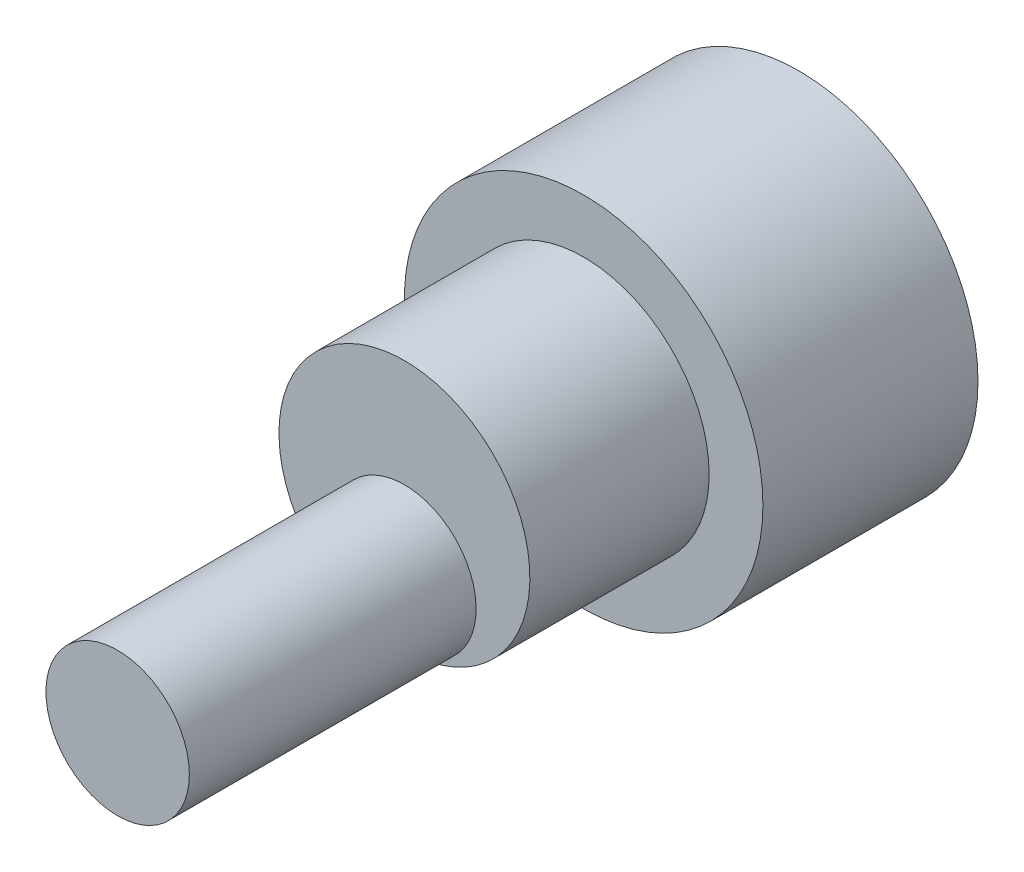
SolidWorks part; units mm, degrees
ref_plane "前视基准面" through (0, 0, 0) normal (0, 0, 1) x (1, 0, 0)
ref_plane "上视基准面" through (0, 0, 0) normal (0, 1, 0) x (1, 0, 0)
ref_plane "右视基准面" through (0, 0, 0) normal (1, 0, 0) x (0, 0, -1)
sketch "草图1" plane through (0, 0, 0) normal (0, 0, 1) x (1, 0, 0)
  circle A0 centre (0, 0) radius 50
  dimension "D1" = 100
extrude "拉伸1" add sketch "草图1" along normal blind 60
sketch "草图2" plane through (0, 0, 60) normal (0, 0, 1) x (1, 0, 0)
  circle A0 centre (0, 0) radius 35
  dimension "D1" = 70
extrude "拉伸2" add sketch "草图2" along normal blind 50
sketch "草图3" plane through (0, 0, 110) normal (0, 0, 1) x (1, 0, 0)
  circle A0 centre (0, -15) radius 20
  circle A1 centre (0, 0) radius 35 construction
  dimension "D1" = 40
extrude "拉伸3" add sketch "草图3" along normal blind 80
